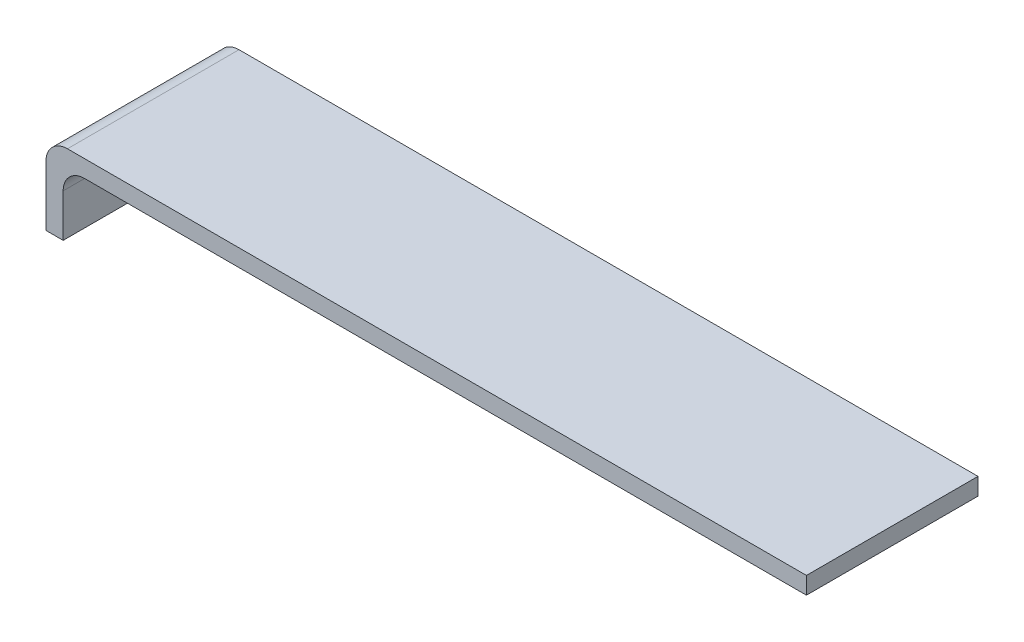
SolidWorks part; units mm, degrees
other "Solid1"
ref_plane "Płaszczyzna przednia" through (0, 0, 0) normal (0, 0, 1) x (1, 0, 0)
ref_plane "Płaszczyzna górna" through (0, 0, 0) normal (0, 1, 0) x (1, 0, 0)
ref_plane "Płaszczyzna prawa" through (0, 0, 0) normal (1, 0, 0) x (0, 0, -1)
imported_body "Import1"
sketch "Szkic1" plane through (0, 0, 4) normal (0, 0, 1) x (1, 0, 0)
  line L0 (-10.4845, 0.754) -> (-23.856, 0.754) construction
  line L1 (-14.4916, 10.2473) -> (-3.9731, 10.2473)
  line L2 (-14.4916, 10.2473) -> (-14.4916, 0.754)
  line L3 (-14.4916, 0.754) -> (-3.9731, 0.754)
  line L4 (-3.9731, 10.2473) -> (-3.9731, 0.754)
  point P4 (-14.4916, 0.754)
extrude "Wytnij-wyciągnięcie1" cut sketch "Szkic1" against normal through all
